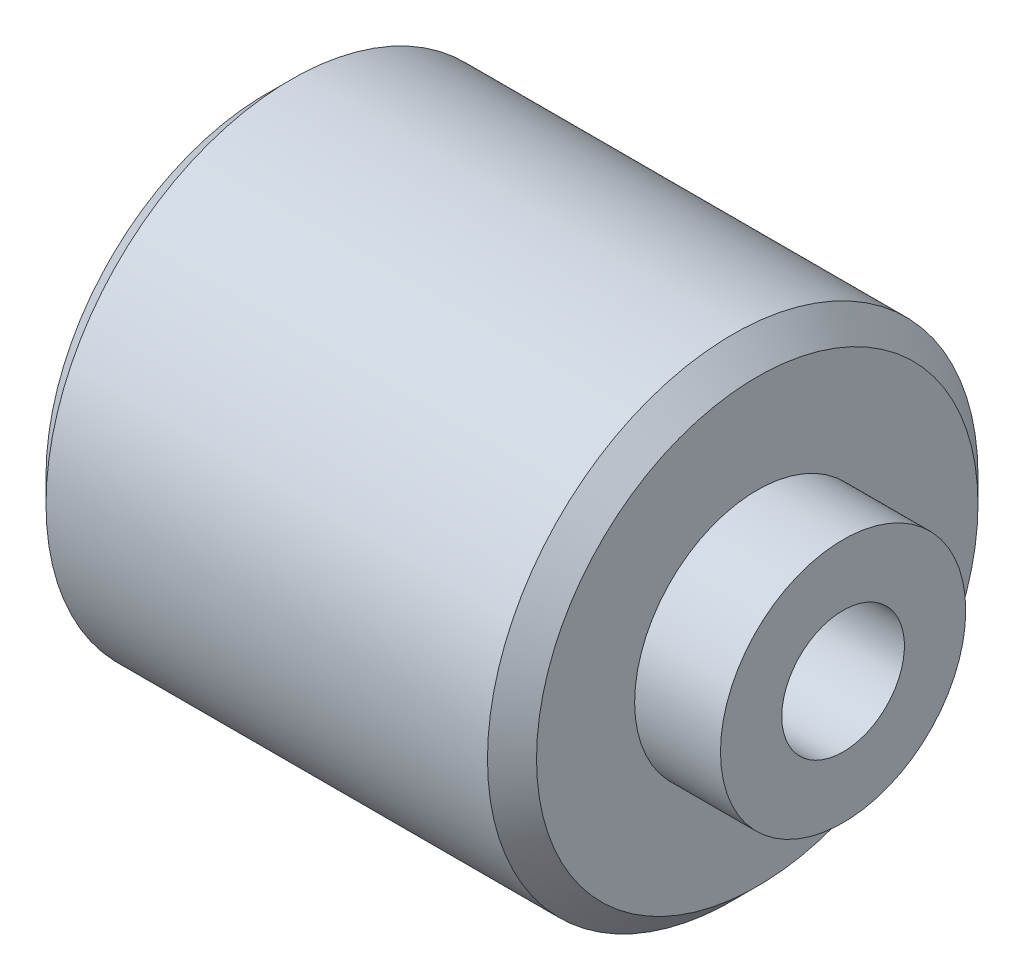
SolidWorks part; units mm, degrees
ref_plane "Front" through (0, 0, 0) normal (0, 0, 1) x (1, 0, 0)
ref_plane "Top" through (0, 0, 0) normal (0, 1, 0) x (1, 0, 0)
ref_plane "Right" through (0, 0, 0) normal (1, 0, 0) x (0, 0, -1)
sketch "Sketch1" plane through (0, 0, 0) normal (0, 1, 0) x (1, 0, 0)
  line L0 (0, 0) -> (23.5, 0) construction
  line L1 (0, 2.5) -> (23.5, 2.5)
  line L2 (23.5, 2.5) -> (23.5, 5)
  line L3 (23.5, 5) -> (20, 5)
  line L4 (20, 5) -> (20, 9)
  line L5 (19, 10) -> (1, 10)
  line L6 (0, 9) -> (0, 2.5)
  line L10 (0, 9) -> (1, 10)
  line L11 (19, 10) -> (20, 9)
revolve "Revolve1" add sketch "Sketch1" angle 360 about L0
